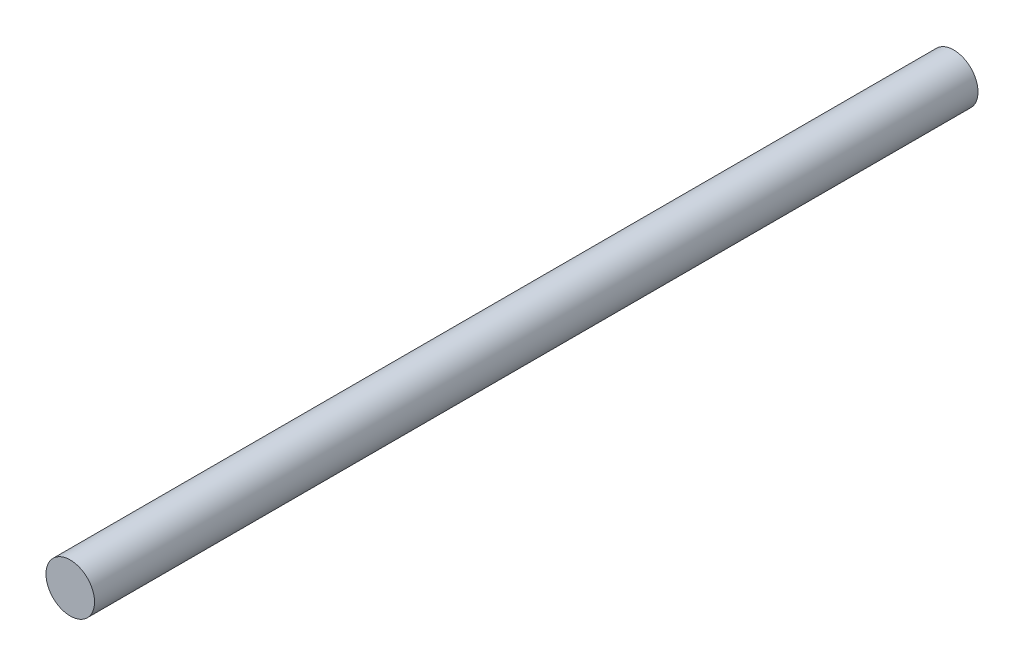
SolidWorks part; units mm, degrees
ref_plane "Front Plane" through (0, 0, 0) normal (0, 0, 1) x (1, 0, 0)
ref_plane "Top Plane" through (0, 0, 0) normal (0, 1, 0) x (1, 0, 0)
ref_plane "Right Plane" through (0, 0, 0) normal (1, 0, 0) x (0, 0, -1)
sketch "Sketch1" plane through (0, 0, 0) normal (0, 0, 1) x (1, 0, 0)
  circle A0 centre (0, 0) radius 2.75
  dimension "OD" = 5.5
extrude "Extrude1" add sketch "Sketch1" along normal mid plane 100
